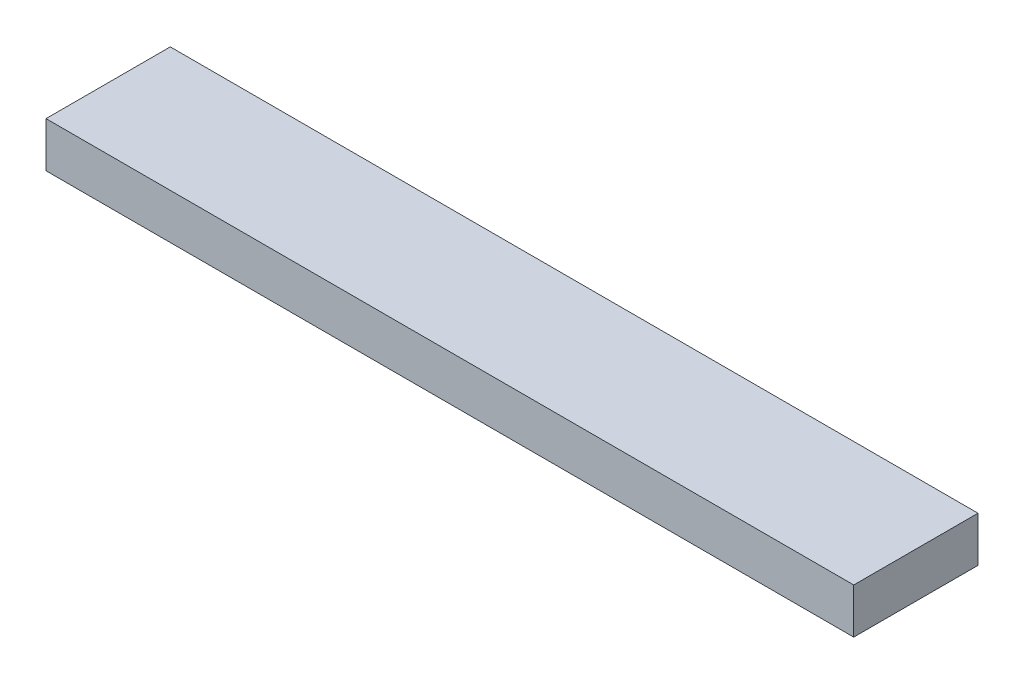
SolidWorks part; units mm, degrees
ref_plane "Front Plane" through (0, 0, 0) normal (0, 0, 1) x (1, 0, 0)
ref_plane "Top Plane" through (0, 0, 0) normal (0, 1, 0) x (1, 0, 0)
ref_plane "Right Plane" through (0, 0, 0) normal (1, 0, 0) x (0, 0, -1)
sketch "Sketch1" plane through (0, 0, 0) normal (1, 0, 0) x (0, 0, -1)
  line L1 (-34.925, 12.7) -> (34.925, 12.7)
  line L2 (-34.925, 12.7) -> (-34.925, -12.7)
  line L3 (-34.925, -12.7) -> (34.925, -12.7)
  line L4 (34.925, 12.7) -> (34.925, -12.7)
  line L5 (-34.925, 12.7) -> (34.925, -12.7) construction
  line L6 (-34.925, -12.7) -> (34.925, 12.7) construction
  point P0 (0, 0)
  dimension "D1" = 25.4
  dimension "D2" = 69.85
extrude "Boss-Extrude1" add sketch "Sketch1" along normal mid plane 454.025
